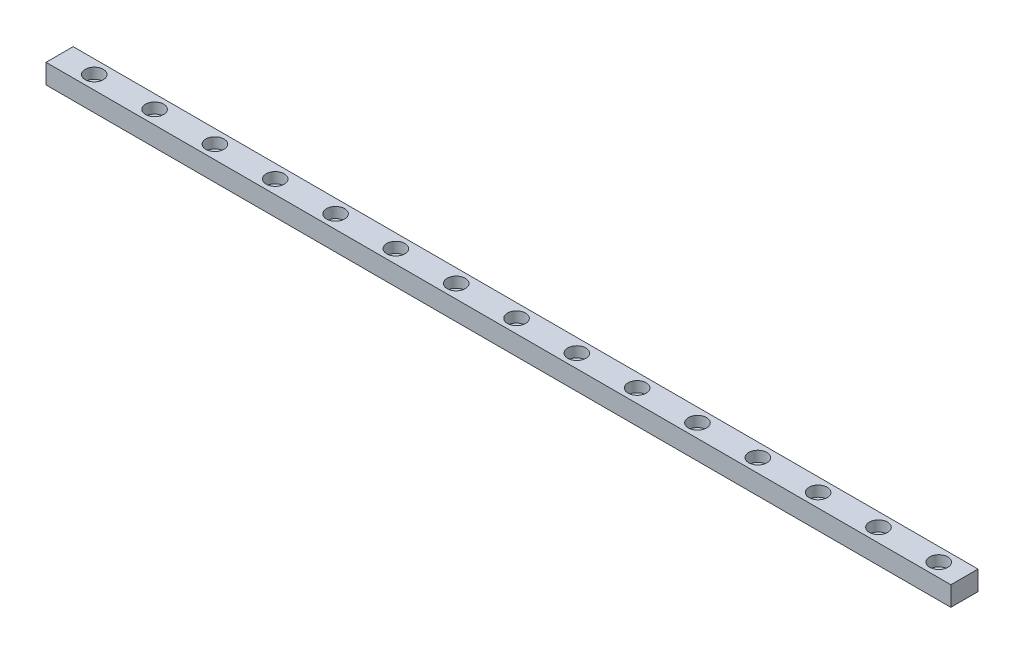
SolidWorks part; units mm, degrees
ref_plane "Front Plane" through (0, 0, 0) normal (0, 0, 1) x (1, 0, 0)
ref_plane "Top Plane" through (0, 0, 0) normal (0, 1, 0) x (1, 0, 0)
ref_plane "Right Plane" through (0, 0, 0) normal (1, 0, 0) x (0, 0, -1)
sketch "Sketch1" plane through (0, 0, 0) normal (1, 0, 0) x (0, 0, -1)
  line L1 (-4.5, 0) -> (-4.5, -6.5)
  line L2 (-4.5, -6.5) -> (4.5, -6.5)
  line L3 (4.5, -6.5) -> (4.5, 0)
  line L4 (4.5, 0) -> (-4.5, 0)
extrude "Boss-Extrude1" add sketch "Sketch1" along normal mid plane 300
sketch "Sketch2" plane through (0, 0, 0) normal (0, 1, 0) x (1, 0, 0)
  circle A0 centre (-138.5, 0) radius 1.5
  circle A1 centre (-118.5, 0) radius 1.5
  circle A2 centre (-98.5, 0) radius 1.5
  circle A3 centre (-78.5, 0) radius 1.5
  circle A4 centre (-58.5, 0) radius 1.5
  circle A5 centre (-38.5, 0) radius 1.5
  circle A6 centre (-18.5, 0) radius 1.5
  circle A7 centre (1.5, 0) radius 1.5
  circle A8 centre (21.5, 0) radius 1.5
  circle A9 centre (41.5, 0) radius 1.5
  circle A10 centre (61.5, 0) radius 1.5
  circle A11 centre (81.5, 0) radius 1.5
  circle A12 centre (101.5, 0) radius 1.5
  circle A13 centre (121.5, 0) radius 1.5
  circle A14 centre (141.5, 0) radius 1.5
  dimension "D1" = 15
extrude "Cut-Extrude1" cut sketch "Sketch2" against normal through all
sketch "Sketch3" plane through (0, 0, 0) normal (0, 1, 0) x (1, 0, 0)
  circle A0 centre (-138.5, 0) radius 3
  circle A1 centre (-118.5, 0) radius 3
  circle A2 centre (-98.5, 0) radius 3
  circle A3 centre (-78.5, 0) radius 3
  circle A4 centre (-58.5, 0) radius 3
  circle A5 centre (-38.5, 0) radius 3
  circle A6 centre (-18.5, 0) radius 3
  circle A7 centre (1.5, 0) radius 3
  circle A8 centre (21.5, 0) radius 3
  circle A9 centre (41.5, 0) radius 3
  circle A10 centre (61.5, 0) radius 3
  circle A11 centre (81.5, 0) radius 3
  circle A12 centre (101.5, 0) radius 3
  circle A13 centre (121.5, 0) radius 3
  circle A14 centre (141.5, 0) radius 3
  dimension "D1" = 15
extrude "Cut-Extrude2" cut sketch "Sketch3" against normal blind 3.5
